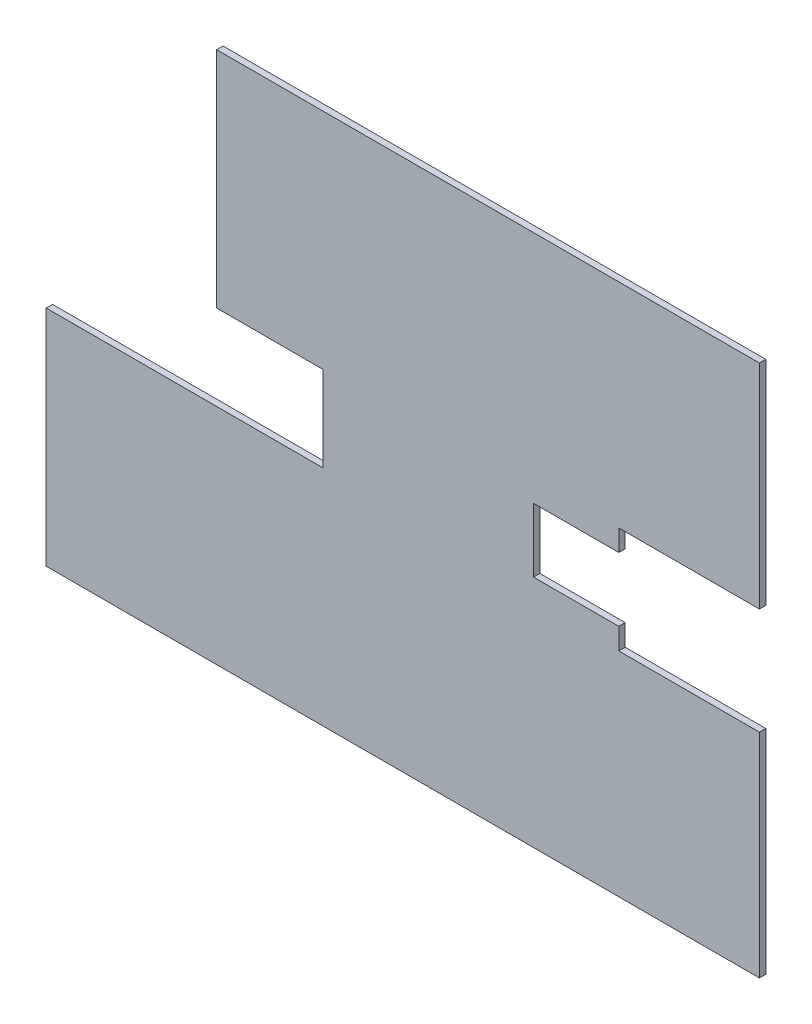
SolidWorks part; units mm, degrees
ref_plane "Plan de face" through (0, 0, 0) normal (0, 0, 1) x (1, 0, 0)
ref_plane "Plan de dessus" through (0, 0, 0) normal (0, 1, 0) x (1, 0, 0)
ref_plane "Plan de droite" through (0, 0, 0) normal (1, 0, 0) x (0, 0, -1)
sketch "Esquisse1" plane through (0, 0, 0) normal (0, 0, 1) x (1, 0, 0)
  line L0 (-167.5, 0) -> (261.0538, 0) construction
  line L1 (-167.2876, -124.9207) -> (167.3938, -124.9207)
  line L2 (-167.2876, -124.9207) -> (-167.2876, -20)
  line L3 (-87.2876, 125) -> (167.3938, 125)
  line L4 (167.3938, -124.9207) -> (167.3938, -25)
  line L5 (-167.2876, -124.9207) -> (167.3938, 125) construction
  line L6 (-167.6061, 125.0791) -> (167.3938, -124.9207) construction
  line L7 (-87.2876, 20) -> (-87.2876, 125)
  line L8 (167.3938, 25) -> (101.3938, 25)
  line L10 (167.3938, -25) -> (101.3938, -25)
  line L11 (101.3938, 25) -> (101.3938, 15)
  line L12 (-167.2876, -20) -> (-37.2876, -20)
  line L14 (-87.2876, 20) -> (-37.2876, 20)
  line L15 (-37.2876, -20) -> (-37.2876, 20)
  line L16 (167.3938, 25) -> (167.3938, 125)
  line L17 (101.3938, -15) -> (101.3938, -25)
  line L22 (101.3938, 15) -> (61.3938, 15)
  line L24 (101.3938, -15) -> (61.3938, -15)
  line L25 (61.3938, 15) -> (61.3938, -15)
  point P0 (0, 0)
  dimension "D1" = 335
  dimension "D2" = 250
  dimension "D3" = 50
  dimension "D4" = 25
  dimension "D5" = 66
  dimension "D6" = 20
  dimension "D7" = 130
  dimension "D8" = 40
  dimension "D9" = 80
  dimension "D13" = 40
  dimension "D14" = 10
  dimension "D15" = 10
extrude "Boss.-Extru.1" add sketch "Esquisse1" along normal blind 3
